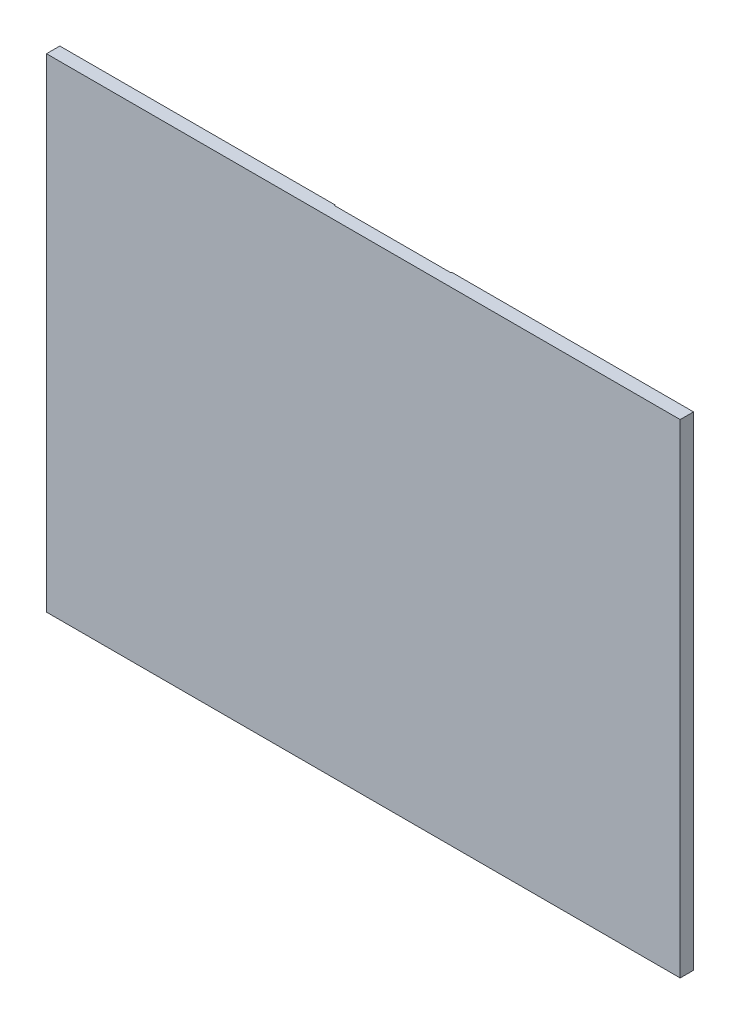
SolidWorks part; units mm, degrees
ref_plane "Plan de face" through (0, 0, 0) normal (0, 0, 1) x (1, 0, 0)
ref_plane "Plan de dessus" through (0, 0, 0) normal (0, 1, 0) x (1, 0, 0)
ref_plane "Plan de droite" through (0, 0, 0) normal (1, 0, 0) x (0, 0, -1)
sketch "Esquisse1" plane through (0, 0, 0) normal (0, 0, 1) x (1, 0, 0)
  line L0 (-18.5, 29) -> (-18.5, -29)
  line L1 (-18.5, 29) -> (57.5, 29)
  line L2 (-18.5, -29) -> (57.5, -29)
  line L4 (57.5, 29) -> (57.5, -29)
extrude "Extrusion1" add sketch "Esquisse1" along normal blind 1.6
sketch "Esquisse2" plane through (0, 0, 0) normal (0, 0, -1) x (-1, 0, 0)
  line L0 (-28.5, 31.6866) -> (-28.5, -31.9742)
  line L1 (-57.5, -29) -> (-57.5, 29) construction
  line L2 (-14.5, 31.6866) -> (-14.5, -31.9742)
  line L3 (-28.5, 31.6866) -> (-14.5, 31.6866)
  line L4 (-28.5, -31.9742) -> (-14.5, -31.9742)
  line L5 (-28.5, 29) -> (-28.5, -29) construction
  line L6 (-14.5, 29) -> (-14.5, -29) construction
  dimension "D1" = 29
  dimension "D2" = 14
extrude "Enlèv. mat.-Extru.1" cut sketch "Esquisse2" against normal blind 0.1
